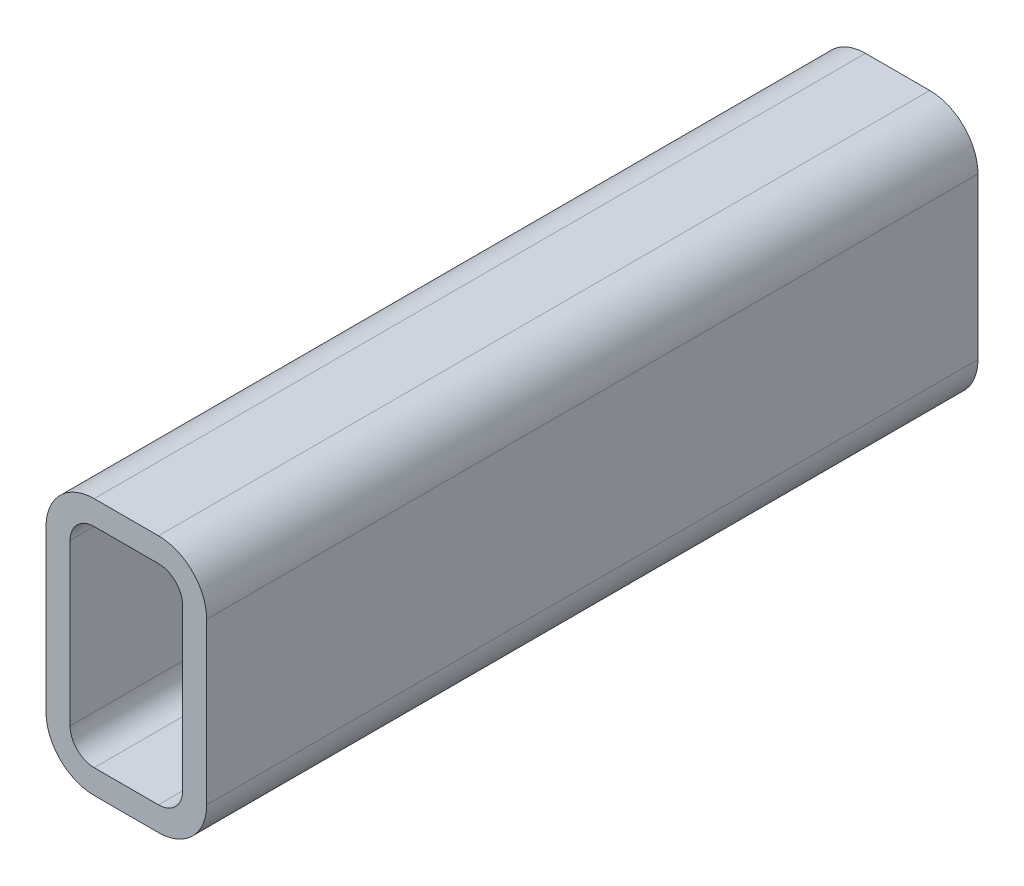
SolidWorks part; units mm, degrees
ref_plane "Front Plane" through (0, 0, 0) normal (0, 0, 1) x (1, 0, 0)
ref_plane "Top Plane" through (0, 0, 0) normal (0, 1, 0) x (1, 0, 0)
ref_plane "Right Plane" through (0, 0, 0) normal (1, 0, 0) x (0, 0, -1)
sketch "Sketch1" plane through (0, 0, 0) normal (0, 0, 1) x (1, 0, 0)
sketch_block_instance "HSS4x2.5x0.375-1"
sketch_block "HSS4x2.5x0.375"
extrude "Boss-Extrude1" add sketch "Sketch1" along normal blind 304.8
